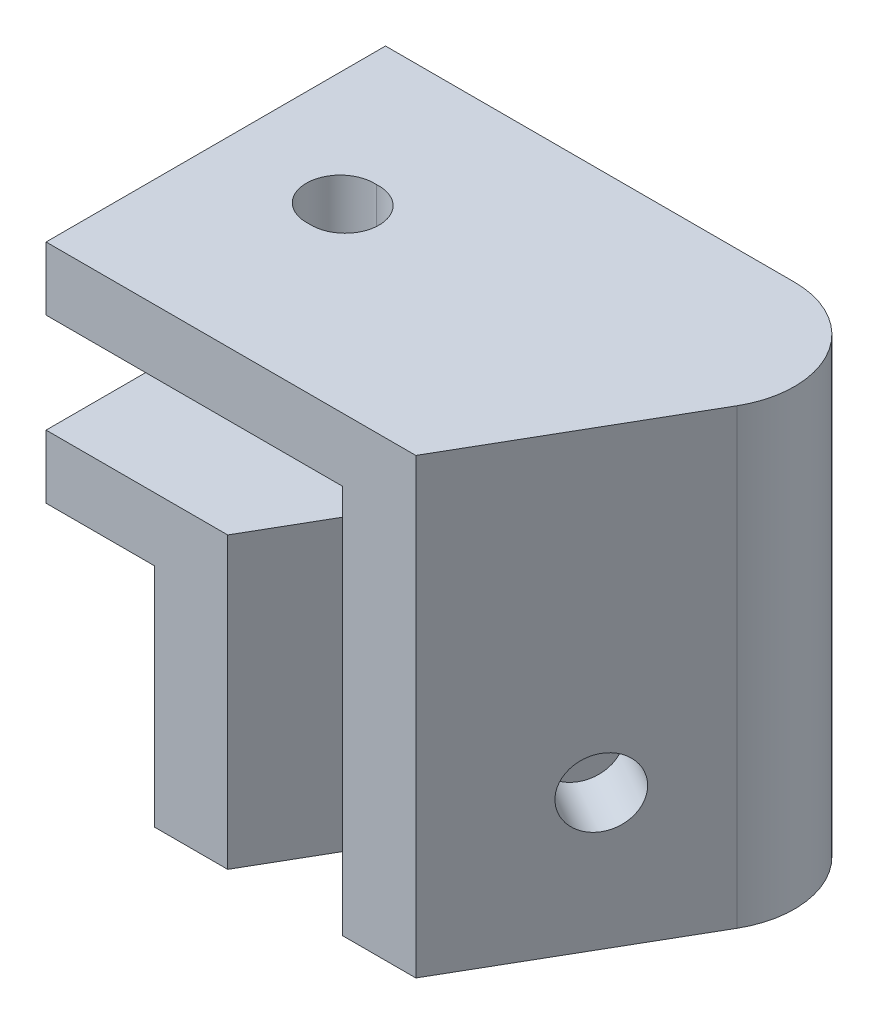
SolidWorks part; units mm, degrees
other "<RmCS-弹舱侧壁连接1_3D>-<切除-拉伸11>"
ref_plane "前视基准面" through (0, 0, 0) normal (0, 0, 1) x (1, 0, 0)
ref_plane "上视基准面" through (0, 0, 0) normal (0, 1, 0) x (1, 0, 0)
ref_plane "右视基准面" through (0, 0, 0) normal (1, 0, 0) x (0, 0, -1)
mirrored part "RmCS-弹舱侧壁连接1_3D镜向"
extrude "切除-拉伸7" cut sketch "草图8" against normal blind 20
sketch "草图8" plane through (-134.0287, 0, 130.5) normal (0, 1, 0) x (1, 0, 0)
  line L2 (24.2864, 135) -> (24.2864, 120.1246) construction
  circle A0 centre (-78.1696, 131) radius 1.5
  circle A1 centre (126.7423, 131) radius 1.5
extrude "切除-拉伸8" cut sketch "草图9" against normal blind 20
sketch "草图9" plane through (-71.7982, -85.3989, 138.5087) normal (0.866, 0, 0.5) x (0, -1, 0)
  line L1 (-3.8989, 161.1181) -> (-3.8989, 143.2827) construction
  circle A0 centre (-71.3989, 157.2758) radius 1.5
  circle A1 centre (63.6011, 157.2758) radius 1.5
